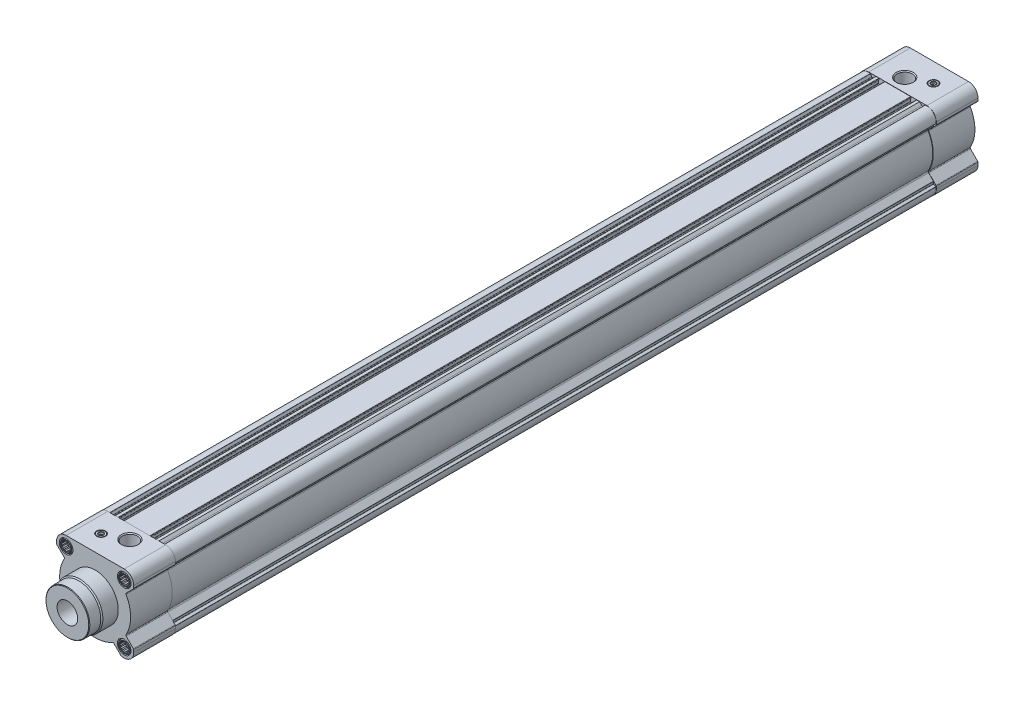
SolidWorks part; units mm, degrees
ref_plane "Plano frontal" through (0, 0, 0) normal (0, 0, 1) x (1, 0, 0)
ref_plane "Plano superior" through (0, 0, 0) normal (0, 1, 0) x (1, 0, 0)
ref_plane "Plano direito" through (0, 0, 0) normal (1, 0, 0) x (0, 0, -1)
imported_body "Bruto-CPME63-700-1"
sketch "Esboço2" plane through (0, 0, 0) normal (1, 0, 0) x (0, 0, -1)
  line L1 (254.1698, 79.139) -> (277.0424, 79.139)
  line L2 (254.1698, 79.139) -> (254.1698, -65.4154)
  line L3 (254.1698, -65.4154) -> (277.0424, -65.4154)
  line L4 (277.0424, 79.139) -> (277.0424, -65.4154)
extrude "Corte-extrusão1" cut sketch "Esboço2" against normal through all both and the other way through all
move or copy body "Corpo-Mover/Copiar1" bodies to move or copy 103 copy no translate (0, 0, 200)
sketch "Esboço3" plane through (0, 0, -54.1698) normal (0, 0, -1) x (-1, 0, 0)
  line L41 (25.3155, -34.95) -> (26.4379, -36.8941)
  line L42 (36.8941, -26.4379) -> (34.95, -25.3155)
  line L43 (34.75, -24.9691) -> (34.75, -23.2484)
  line L44 (34.6328, -22.9656) -> (29.9706, -18.3033)
  line L45 (29.9706, 18.3033) -> (34.6328, 22.9656)
  line L46 (34.75, 23.2484) -> (34.75, 24.9691)
  line L47 (34.95, 25.3155) -> (36.8941, 26.4379)
  line L48 (26.4379, 36.8941) -> (25.3155, 34.95)
  line L49 (24.9691, 34.75) -> (24.3713, 34.75)
  line L50 (23.3107, 35.1893) -> (21.25, 37.25)
  line L51 (21.25, 37.25) -> (18.5, 37.25)
  line L52 (18.1, 36.85) -> (18.1, 35.95)
  line L53 (18.3, 35.75) -> (18.55, 35.75)
  line L54 (18.75, 35.55) -> (18.75, 32.95)
  line L55 (18.35, 32.55) -> (12.65, 32.55)
  line L56 (12.25, 32.95) -> (12.25, 35.55)
  line L57 (12.45, 35.75) -> (12.7, 35.75)
  line L58 (12.9, 35.95) -> (12.9, 36.85)
  line L59 (12.5, 37.25) -> (-12.5, 37.25)
  line L60 (-12.9, 36.85) -> (-12.9, 35.95)
  line L61 (-12.7, 35.75) -> (-12.45, 35.75)
  line L62 (-12.25, 35.55) -> (-12.25, 32.95)
  line L63 (-12.65, 32.55) -> (-18.35, 32.55)
  line L64 (-18.75, 32.95) -> (-18.75, 35.55)
  line L65 (-18.55, 35.75) -> (-18.3, 35.75)
  line L66 (-18.1, 35.95) -> (-18.1, 36.85)
  line L67 (-18.5, 37.25) -> (-21.25, 37.25)
  line L68 (-21.25, 37.25) -> (-23.3107, 35.1893)
  line L69 (-24.3713, 34.75) -> (-24.9691, 34.75)
  line L70 (-25.3155, 34.95) -> (-26.4379, 36.8941)
  line L71 (-36.8941, 26.4379) -> (-34.95, 25.3155)
  line L72 (-34.75, 24.9691) -> (-34.75, 23.2484)
  line L73 (-34.6328, 22.9656) -> (-29.9706, 18.3033)
  line L74 (-29.9706, -18.3033) -> (-34.6328, -22.9656)
  line L75 (-34.75, -23.2484) -> (-34.75, -24.9691)
  line L76 (-34.95, -25.3155) -> (-36.8941, -26.4379)
  line L77 (-26.4379, -36.8941) -> (-25.3155, -34.95)
  line L78 (-24.9691, -34.75) -> (-23.2484, -34.75)
  line L79 (-22.9656, -34.6328) -> (-18.3033, -29.9706)
  line L80 (18.3033, -29.9706) -> (22.9656, -34.6328)
  line L81 (23.2484, -34.75) -> (24.9691, -34.75)
  line L82 (25.3155, -34.95) -> (26.4379, -36.8941)
  line L83 (36.8941, -26.4379) -> (34.95, -25.3155)
  line L84 (34.75, -24.9691) -> (34.75, -23.2484)
  line L85 (34.6328, -22.9656) -> (29.9706, -18.3033)
  line L86 (29.9706, 18.3033) -> (34.6328, 22.9656)
  line L87 (34.75, 23.2484) -> (34.75, 24.9691)
  line L88 (34.95, 25.3155) -> (36.8941, 26.4379)
  line L89 (26.4379, 36.8941) -> (25.3155, 34.95)
  line L90 (24.9691, 34.75) -> (24.3713, 34.75)
  line L91 (23.3107, 35.1893) -> (21.25, 37.25)
  line L92 (21.25, 37.25) -> (18.5, 37.25)
  line L93 (18.1, 36.85) -> (18.1, 35.95)
  line L94 (18.3, 35.75) -> (18.55, 35.75)
  line L95 (18.75, 35.55) -> (18.75, 32.95)
  line L96 (18.35, 32.55) -> (12.65, 32.55)
  line L97 (12.25, 32.95) -> (12.25, 35.55)
  line L98 (12.45, 35.75) -> (12.7, 35.75)
  line L99 (12.9, 35.95) -> (12.9, 36.85)
  line L100 (12.5, 37.25) -> (-12.5, 37.25)
  line L101 (-12.9, 36.85) -> (-12.9, 35.95)
  line L102 (-12.7, 35.75) -> (-12.45, 35.75)
  line L103 (-12.25, 35.55) -> (-12.25, 32.95)
  line L104 (-12.65, 32.55) -> (-18.35, 32.55)
  line L105 (-18.75, 32.95) -> (-18.75, 35.55)
  line L106 (-18.55, 35.75) -> (-18.3, 35.75)
  line L107 (-18.1, 35.95) -> (-18.1, 36.85)
  line L108 (-18.5, 37.25) -> (-21.25, 37.25)
  line L109 (-21.25, 37.25) -> (-23.3107, 35.1893)
  line L110 (-24.3713, 34.75) -> (-24.9691, 34.75)
  line L111 (-25.3155, 34.95) -> (-26.4379, 36.8941)
  line L112 (-36.8941, 26.4379) -> (-34.95, 25.3155)
  line L113 (-34.75, 24.9691) -> (-34.75, 23.2484)
  line L114 (-34.6328, 22.9656) -> (-29.9706, 18.3033)
  line L115 (-29.9706, -18.3033) -> (-34.6328, -22.9656)
  line L116 (-34.75, -23.2484) -> (-34.75, -24.9691)
  line L117 (-34.95, -25.3155) -> (-36.8941, -26.4379)
  line L118 (-26.4379, -36.8941) -> (-25.3155, -34.95)
  line L119 (-24.9691, -34.75) -> (-23.2484, -34.75)
  line L120 (-22.9656, -34.6328) -> (-18.3033, -29.9706)
  line L121 (18.3033, -29.9706) -> (22.9656, -34.6328)
  line L122 (23.2484, -34.75) -> (24.9691, -34.75)
  circle A0 centre (0, 0) radius 31.5 construction
  circle A1 centre (0, 0) radius 31.5
  arc A53 (26.4379, -36.8941) -> (26.7078, -37.0867) centre (26.7843, -36.6941) ccw
  arc A54 (26.7078, -37.0867) -> (37.0867, -26.7078) centre (28.4, -28.4) ccw
  arc A55 (37.0867, -26.7078) -> (36.8941, -26.4379) centre (36.6941, -26.7843) ccw
  arc A56 (34.75, -24.9691) -> (34.95, -25.3155) centre (35.15, -24.9691) ccw
  arc A57 (34.75, -23.2484) -> (34.6328, -22.9656) centre (34.35, -23.2484) ccw
  arc A58 (29.7201, -16.5141) -> (29.9706, -18.3033) centre (31.0313, -17.2427) ccw
  arc A59 (29.7201, -16.5141) -> (29.7201, 16.5141) centre (0, 0) ccw
  arc A60 (29.9706, 18.3033) -> (29.7201, 16.5141) centre (31.0313, 17.2427) ccw
  arc A61 (34.6328, 22.9656) -> (34.75, 23.2484) centre (34.35, 23.2484) ccw
  arc A62 (34.95, 25.3155) -> (34.75, 24.9691) centre (35.15, 24.9691) ccw
  arc A63 (36.8941, 26.4379) -> (37.0867, 26.7078) centre (36.6941, 26.7843) ccw
  arc A64 (37.0867, 26.7078) -> (26.7078, 37.0867) centre (28.4, 28.4) ccw
  arc A65 (26.7078, 37.0867) -> (26.4379, 36.8941) centre (26.7843, 36.6941) ccw
  arc A66 (24.9691, 34.75) -> (25.3155, 34.95) centre (24.9691, 35.15) ccw
  arc A67 (23.3107, 35.1893) -> (24.3713, 34.75) centre (24.3713, 36.25) ccw
  arc A68 (18.5, 37.25) -> (18.1, 36.85) centre (18.5, 36.85) ccw
  arc A69 (18.1, 35.95) -> (18.3, 35.75) centre (18.3, 35.95) ccw
  arc A70 (18.75, 35.55) -> (18.55, 35.75) centre (18.55, 35.55) ccw
  arc A71 (18.35, 32.55) -> (18.75, 32.95) centre (18.35, 32.95) ccw
  arc A72 (12.25, 32.95) -> (12.65, 32.55) centre (12.65, 32.95) ccw
  arc A73 (12.45, 35.75) -> (12.25, 35.55) centre (12.45, 35.55) ccw
  arc A74 (12.7, 35.75) -> (12.9, 35.95) centre (12.7, 35.95) ccw
  arc A75 (12.9, 36.85) -> (12.5, 37.25) centre (12.5, 36.85) ccw
  arc A76 (-12.5, 37.25) -> (-12.9, 36.85) centre (-12.5, 36.85) ccw
  arc A77 (-12.9, 35.95) -> (-12.7, 35.75) centre (-12.7, 35.95) ccw
  arc A78 (-12.25, 35.55) -> (-12.45, 35.75) centre (-12.45, 35.55) ccw
  arc A79 (-12.65, 32.55) -> (-12.25, 32.95) centre (-12.65, 32.95) ccw
  arc A80 (-18.75, 32.95) -> (-18.35, 32.55) centre (-18.35, 32.95) ccw
  arc A81 (-18.55, 35.75) -> (-18.75, 35.55) centre (-18.55, 35.55) ccw
  arc A82 (-18.3, 35.75) -> (-18.1, 35.95) centre (-18.3, 35.95) ccw
  arc A83 (-18.1, 36.85) -> (-18.5, 37.25) centre (-18.5, 36.85) ccw
  arc A84 (-24.3713, 34.75) -> (-23.3107, 35.1893) centre (-24.3713, 36.25) ccw
  arc A85 (-25.3155, 34.95) -> (-24.9691, 34.75) centre (-24.9691, 35.15) ccw
  arc A86 (-26.4379, 36.8941) -> (-26.7078, 37.0867) centre (-26.7843, 36.6941) ccw
  arc A87 (-26.7078, 37.0867) -> (-37.0867, 26.7078) centre (-28.4, 28.4) ccw
  arc A88 (-37.0867, 26.7078) -> (-36.8941, 26.4379) centre (-36.6941, 26.7843) ccw
  arc A89 (-34.75, 24.9691) -> (-34.95, 25.3155) centre (-35.15, 24.9691) ccw
  arc A90 (-34.75, 23.2484) -> (-34.6328, 22.9656) centre (-34.35, 23.2484) ccw
  arc A91 (-29.7201, 16.5141) -> (-29.9706, 18.3033) centre (-31.0313, 17.2427) ccw
  arc A92 (-29.7201, 16.5141) -> (-29.7201, -16.5141) centre (0, 0) ccw
  arc A93 (-29.9706, -18.3033) -> (-29.7201, -16.5141) centre (-31.0313, -17.2427) ccw
  arc A94 (-34.6328, -22.9656) -> (-34.75, -23.2484) centre (-34.35, -23.2484) ccw
  arc A95 (-34.95, -25.3155) -> (-34.75, -24.9691) centre (-35.15, -24.9691) ccw
  arc A96 (-36.8941, -26.4379) -> (-37.0867, -26.7078) centre (-36.6941, -26.7843) ccw
  arc A97 (-37.0867, -26.7078) -> (-26.7078, -37.0867) centre (-28.4, -28.4) ccw
  arc A98 (-26.7078, -37.0867) -> (-26.4379, -36.8941) centre (-26.7843, -36.6941) ccw
  arc A99 (-24.9691, -34.75) -> (-25.3155, -34.95) centre (-24.9691, -35.15) ccw
  arc A100 (-23.2484, -34.75) -> (-22.9656, -34.6328) centre (-23.2484, -34.35) ccw
  arc A101 (-16.5141, -29.7201) -> (-18.3033, -29.9706) centre (-17.2427, -31.0313) ccw
  arc A102 (-16.5141, -29.7201) -> (16.5141, -29.7201) centre (0, 0) ccw
  arc A103 (18.3033, -29.9706) -> (16.5141, -29.7201) centre (17.2427, -31.0313) ccw
  arc A104 (22.9656, -34.6328) -> (23.2484, -34.75) centre (23.2484, -34.35) ccw
  arc A105 (25.3155, -34.95) -> (24.9691, -34.75) centre (24.9691, -35.15) ccw
  arc A106 (26.4379, -36.8941) -> (26.7078, -37.0867) centre (26.7843, -36.6941) ccw
  arc A107 (26.7078, -37.0867) -> (37.0867, -26.7078) centre (28.4, -28.4) ccw
  arc A108 (37.0867, -26.7078) -> (36.8941, -26.4379) centre (36.6941, -26.7843) ccw
  arc A109 (34.75, -24.9691) -> (34.95, -25.3155) centre (35.15, -24.9691) ccw
  arc A110 (34.75, -23.2484) -> (34.6328, -22.9656) centre (34.35, -23.2484) ccw
  arc A111 (29.7201, -16.5141) -> (29.9706, -18.3033) centre (31.0313, -17.2427) ccw
  arc A112 (29.7201, -16.5141) -> (29.7201, 16.5141) centre (0, 0) ccw
  arc A113 (29.9706, 18.3033) -> (29.7201, 16.5141) centre (31.0313, 17.2427) ccw
  arc A114 (34.6328, 22.9656) -> (34.75, 23.2484) centre (34.35, 23.2484) ccw
  arc A115 (34.95, 25.3155) -> (34.75, 24.9691) centre (35.15, 24.9691) ccw
  arc A116 (36.8941, 26.4379) -> (37.0867, 26.7078) centre (36.6941, 26.7843) ccw
  arc A117 (37.0867, 26.7078) -> (26.7078, 37.0867) centre (28.4, 28.4) ccw
  arc A118 (26.7078, 37.0867) -> (26.4379, 36.8941) centre (26.7843, 36.6941) ccw
  arc A119 (24.9691, 34.75) -> (25.3155, 34.95) centre (24.9691, 35.15) ccw
  arc A120 (23.3107, 35.1893) -> (24.3713, 34.75) centre (24.3713, 36.25) ccw
  arc A121 (18.5, 37.25) -> (18.1, 36.85) centre (18.5, 36.85) ccw
  arc A122 (18.1, 35.95) -> (18.3, 35.75) centre (18.3, 35.95) ccw
  arc A123 (18.75, 35.55) -> (18.55, 35.75) centre (18.55, 35.55) ccw
  arc A124 (18.35, 32.55) -> (18.75, 32.95) centre (18.35, 32.95) ccw
  arc A125 (12.25, 32.95) -> (12.65, 32.55) centre (12.65, 32.95) ccw
  arc A126 (12.45, 35.75) -> (12.25, 35.55) centre (12.45, 35.55) ccw
  arc A127 (12.7, 35.75) -> (12.9, 35.95) centre (12.7, 35.95) ccw
  arc A128 (12.9, 36.85) -> (12.5, 37.25) centre (12.5, 36.85) ccw
  arc A129 (-12.5, 37.25) -> (-12.9, 36.85) centre (-12.5, 36.85) ccw
  arc A130 (-12.9, 35.95) -> (-12.7, 35.75) centre (-12.7, 35.95) ccw
  arc A131 (-12.25, 35.55) -> (-12.45, 35.75) centre (-12.45, 35.55) ccw
  arc A132 (-12.65, 32.55) -> (-12.25, 32.95) centre (-12.65, 32.95) ccw
  arc A133 (-18.75, 32.95) -> (-18.35, 32.55) centre (-18.35, 32.95) ccw
  arc A134 (-18.55, 35.75) -> (-18.75, 35.55) centre (-18.55, 35.55) ccw
  arc A135 (-18.3, 35.75) -> (-18.1, 35.95) centre (-18.3, 35.95) ccw
  arc A136 (-18.1, 36.85) -> (-18.5, 37.25) centre (-18.5, 36.85) ccw
  arc A137 (-24.3713, 34.75) -> (-23.3107, 35.1893) centre (-24.3713, 36.25) ccw
  arc A138 (-25.3155, 34.95) -> (-24.9691, 34.75) centre (-24.9691, 35.15) ccw
  arc A139 (-26.4379, 36.8941) -> (-26.7078, 37.0867) centre (-26.7843, 36.6941) ccw
  arc A140 (-26.7078, 37.0867) -> (-37.0867, 26.7078) centre (-28.4, 28.4) ccw
  arc A141 (-37.0867, 26.7078) -> (-36.8941, 26.4379) centre (-36.6941, 26.7843) ccw
  arc A142 (-34.75, 24.9691) -> (-34.95, 25.3155) centre (-35.15, 24.9691) ccw
  arc A143 (-34.75, 23.2484) -> (-34.6328, 22.9656) centre (-34.35, 23.2484) ccw
  arc A144 (-29.7201, 16.5141) -> (-29.9706, 18.3033) centre (-31.0313, 17.2427) ccw
  arc A145 (-29.7201, 16.5141) -> (-29.7201, -16.5141) centre (0, 0) ccw
  arc A146 (-29.9706, -18.3033) -> (-29.7201, -16.5141) centre (-31.0313, -17.2427) ccw
  arc A147 (-34.6328, -22.9656) -> (-34.75, -23.2484) centre (-34.35, -23.2484) ccw
  arc A148 (-34.95, -25.3155) -> (-34.75, -24.9691) centre (-35.15, -24.9691) ccw
  arc A149 (-36.8941, -26.4379) -> (-37.0867, -26.7078) centre (-36.6941, -26.7843) ccw
  arc A150 (-37.0867, -26.7078) -> (-26.7078, -37.0867) centre (-28.4, -28.4) ccw
  arc A151 (-26.7078, -37.0867) -> (-26.4379, -36.8941) centre (-26.7843, -36.6941) ccw
  arc A152 (-24.9691, -34.75) -> (-25.3155, -34.95) centre (-24.9691, -35.15) ccw
  arc A153 (-23.2484, -34.75) -> (-22.9656, -34.6328) centre (-23.2484, -34.35) ccw
  arc A154 (-16.5141, -29.7201) -> (-18.3033, -29.9706) centre (-17.2427, -31.0313) ccw
  arc A155 (-16.5141, -29.7201) -> (16.5141, -29.7201) centre (0, 0) ccw
  arc A156 (18.3033, -29.9706) -> (16.5141, -29.7201) centre (17.2427, -31.0313) ccw
  arc A157 (22.9656, -34.6328) -> (23.2484, -34.75) centre (23.2484, -34.35) ccw
  arc A158 (25.3155, -34.95) -> (24.9691, -34.75) centre (24.9691, -35.15) ccw
  dimension "D1" = 0
extrude "Ressalto-extrusão1" add sketch "Esboço3" along normal up to next
